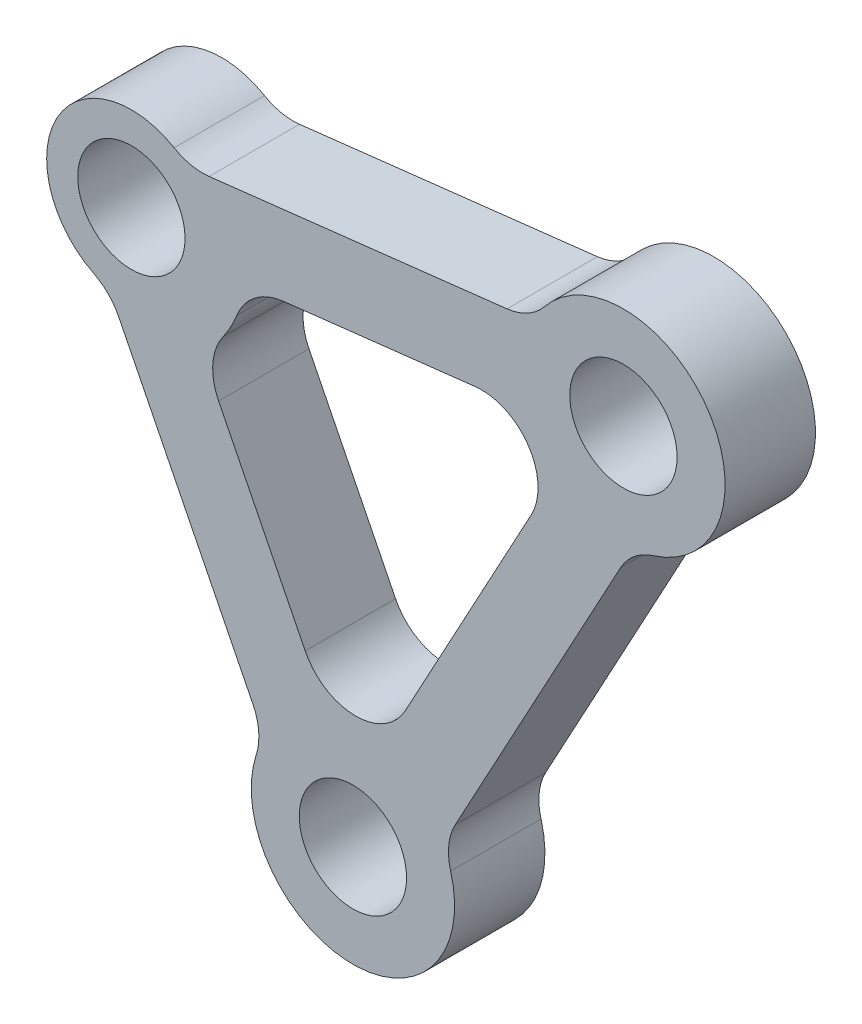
SolidWorks part; units mm, degrees
ref_plane "Face" through (0, 0, 0) normal (0, 0, 1) x (1, 0, 0)
ref_plane "Dessus" through (0, 0, 0) normal (0, 1, 0) x (1, 0, 0)
ref_plane "Droite" through (0, 0, 0) normal (1, 0, 0) x (0, 0, -1)
imported_body "Importée1"
sketch "Esquisse1" plane through (0, 0, 37) normal (0, 0, 1) x (1, 0, 0)
  circle A0 centre (60.6999, 219.3355) radius 4.75
  circle A1 centre (60.6999, 219.3355) radius 4.05 construction
  circle A2 centre (17.14, 214.32) radius 4.75
  circle A3 centre (36.7514, 175.1025) radius 4.75
  circle A4 centre (17.14, 214.32) radius 4.05 construction
  circle A5 centre (36.7514, 175.1025) radius 4.05 construction
  dimension "D1" = 9.5
extrude "Enlèv. mat.-Extru.1" cut sketch "Esquisse1" against normal through all
